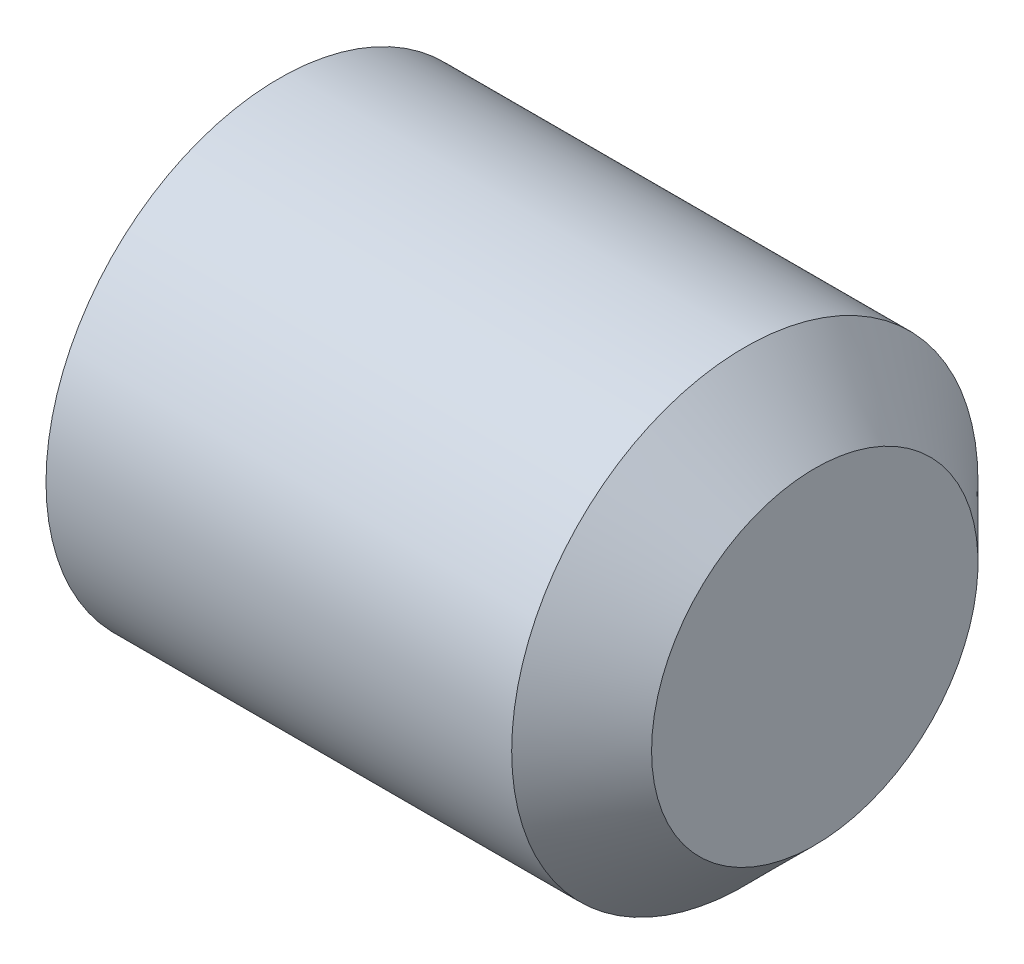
SolidWorks part; units mm, degrees
revolve "BaseBody" add sketch "BodySke" angle 360 about L5
sketch "BodySke" plane through (0, 0, 0) normal (0, 0, 1) x (1, 0, 0)
  line L0 (0, 0) -> (0, 2.055)
  line L1 (0, 2.055) -> (0.2569, 2.5)
  line L2 (0.2569, 2.5) -> (5.25, 2.5)
  line L3 (5.25, 2.5) -> (6, 1.75)
  line L4 (6, 0) -> (0, 0)
  line L5 (-12.7, 0) -> (88.9, 0) construction
  line L6 (6, 1.75) -> (6, 0)
  line L7 (6, 1.75) -> (6, 11.275) construction
  line L8 (0, -2.055) -> (0.2569, -2.5) construction
  line L9 (0.8, 15.875) -> (0.8, -3.175) construction
  line L10 (5.25, -2.5) -> (6, -1.75) construction
  dimension "Length" = 6
  dimension "Diameter" = 5
  dimension "Drive_ch_ang" = 60
  dimension "Minor_dia" = 4.11
  dimension "Cup_nose_ang" = 45
  dimension "Cup_dia" = 3.5
  dimension "Advance" = 0.8
ref_plane "Plane1" through (0, 0, 0) normal (0, 0, 1) x (1, 0, 0)
ref_plane "Plane2" through (0, 0, 0) normal (0, 1, 0) x (1, 0, 0)
ref_plane "Plane3" through (0, 0, 0) normal (1, 0, 0) x (0, 0, -1)
sketch "Sketch2" plane through (0, 0, 0) normal (-1, 0, 0) x (0, 0, 1)
  line L0 (0.7217, 1.25) -> (-0.7217, 1.25)
  line L1 (-0.7217, 1.25) -> (-1.4434, 0)
  line L2 (0.7217, 1.25) -> (1.4434, 0)
  line L3 (0.7217, -1.25) -> (1.4434, 0)
  line L4 (0.7217, -1.25) -> (-0.7217, -1.25)
  line L5 (-0.7217, -1.25) -> (-1.4434, 0)
extrude "Hex" cut sketch "Sketch2" against normal blind 2
sketch "ThdSchSke" plane through (0, 0, 0) normal (0, 0, 1) x (1, 0, 0)
  line L0 (0.2569, -2.055) -> (-0.0547, -2.5)
  line L1 (0.2569, -2.055) -> (0.5685, -2.5)
  line L2 (0.5685, -2.5) -> (0.5685, -3.125)
  line L3 (-3.175, 0) -> (5.1513, 0) construction
  line L5 (0.5685, -3.125) -> (-0.0547, -3.125)
  line L6 (-0.0547, -3.125) -> (-0.0547, -2.5)
  line L8 (0.2569, 2.5) -> (0.2569, -2.5) construction
revolve "ThreadSchematic" [suppressed] cut sketch "ThdSchSke" angle 360 about L3
pattern_linear "ThdSchPat" [suppressed]
thread "Filetage1" pitch 0.8 start angle 0, offset 5, length 15, pitch 0.8, diameter 5
ref_plane "Plan1" through (10.25, 0, 2.5) normal (0, -1, 0) x (0, 0, 1)
sketch "Profil de filetage1" plane through (10.25, 0, 2.5) normal (0, -1, 0) x (0, 0, 1)
  line L0 (0, 0) -> (0, 0.8) construction
  line L11 (0, 0) -> (0, 0.7)
  line L12 (0, 0.7) -> (-0.433, 0.45)
  line L13 (-0.433, 0.45) -> (-0.433, 0.25)
  line L15 (-0.433, 0.25) -> (0, 0)
  line L17 (-0.433, 0.35) -> (0, 0.35) construction
  point P2 (0, 0)
  dimension "Pitch" = 0.8
  dimension "Profile_Angle" = 60
  dimension "Profile_Land" = 0.2
  dimension "Profile_Height" = 0.433
equation "\"D2@Sketch2\" = \"Hex_size@Sketch2\" / 2"
equation "\"D3@Sketch2\" = \"Hex_size@Sketch2\" / 2"
equation "\"Diameter@ThdSchSke\" = \"Diameter@BodySke\""
equation "\"Overcut@ThdSchSke\" = \"Diameter@BodySke\" * 1.25"
equation "\"Num_threads@ThdSchPat\" = int( (\"Length@BodySke\" - ( ( ( \"Diameter@BodySke\" - \"Minor_dia@BodySke\" ) * 0.5 ) / tan( \"Drive_ch_ang@BodySke\" * 0.017453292 ) ) - ( ( ( \"Diameter@BodySke\" - \"Cup_dia@BodySk"
equation "\"Advance@ThdSchPat\" = (\"Length@BodySke\" - ( ( ( \"Diameter@BodySke\" - \"Minor_dia@BodySke\" ) * 0.5 ) / tan( \"Drive_ch_ang@BodySke\" * 0.017453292 ) ) - ( ( ( \"Diameter@BodySke\" - \"Cup_dia@BodySke\" ) * 0."
equation "' \"Num_threads@ThdSchPat\" = \"Num_threads@ThdSchPat\" - sgn( \"Num_threads@ThdSchPat\" - 1) '---chamfered tips only---"
